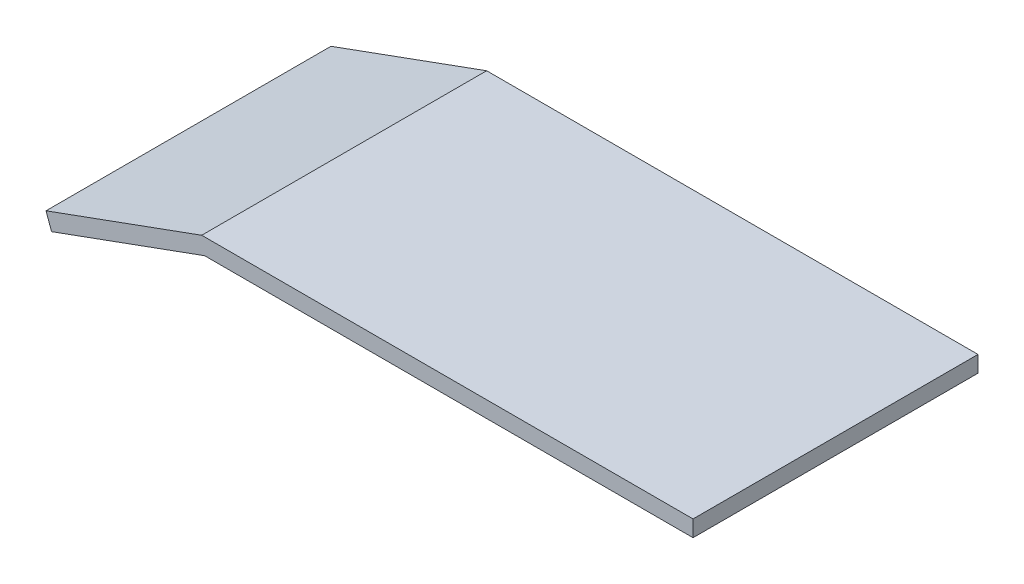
SolidWorks part; units mm, degrees
ref_plane "Ebene vorne" through (0, 0, 0) normal (0, 0, 1) x (1, 0, 0)
ref_plane "Ebene oben" through (0, 0, 0) normal (0, 1, 0) x (1, 0, 0)
ref_plane "Ebene rechts" through (0, 0, 0) normal (1, 0, 0) x (0, 0, -1)
sketch "Skizze1" plane through (0, 0, 0) normal (0, 0, 1) x (1, 0, 0)
  line L0 (40.9961, 20.0731) -> (-19.0039, 20.0731)
  line L1 (-19.0039, 20.0731) -> (-37.7977, 13.2327)
  circle A0 centre (50, 0) radius 20 construction
  circle A2 centre (-50, 0) radius 20 construction
  dimension "D1" = 2
  dimension "D2" = 2
  dimension "D3" = 20
  dimension "D4" = 60
  dimension "D5" = 20
extrude "Linear-Austragen-Dünn1" add sketch "Skizze1" against normal blind 35 thin
